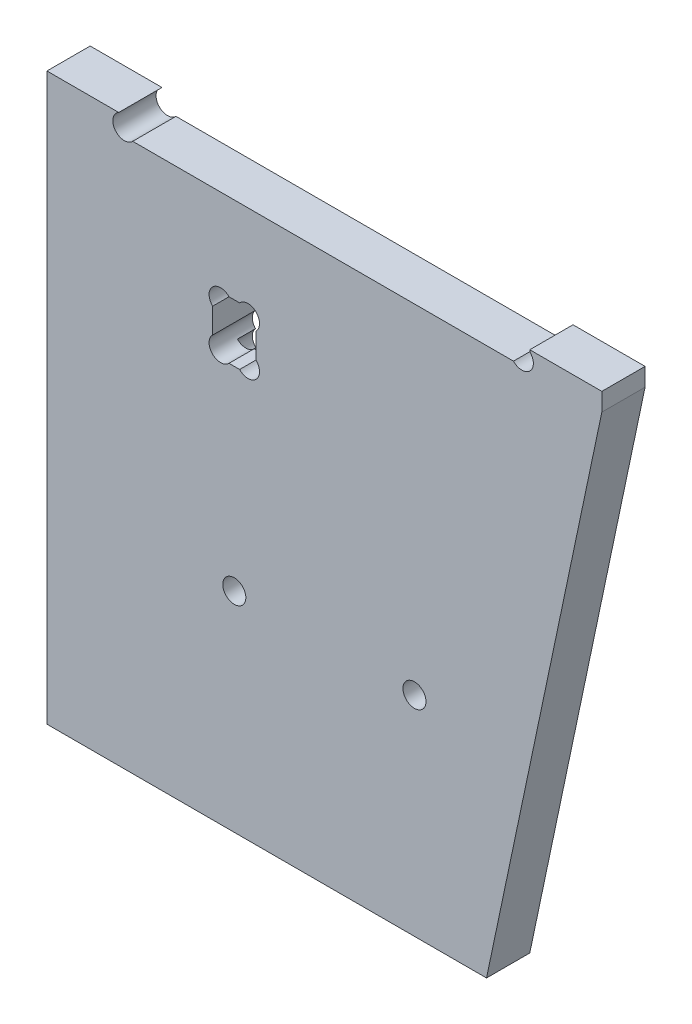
SolidWorks part; units mm, degrees
ref_plane "Plan de face" through (0, 0, 0) normal (0, 0, 1) x (1, 0, 0)
ref_plane "Plan de dessus" through (0, 0, 0) normal (0, 1, 0) x (1, 0, 0)
ref_plane "Plan de droite" through (0, 0, 0) normal (1, 0, 0) x (0, 0, -1)
sketch "Esquisse1" plane through (0, 0, 0) normal (0, 0, 1) x (1, 0, 0)
  line L0 (0, 65.0081) -> (0, -9.9384) construction
  line L1 (11.7393, 0) -> (-31.8718, 0) construction
  line L2 (9.1967, 12) -> (-23.9296, 12) construction
  line L3 (9.1967, 42) -> (-19.8178, 42) construction
  line L4 (9.1967, 54) -> (-19.8178, 54) construction
  line L5 (-6, 65.0081) -> (-6, -9.9384) construction
  line L6 (2.8612, 42) -> (2.8612, 12) construction
  line L7 (1.6817, 48) -> (-10.3124, 48) construction
  line L8 (-2.2619, 54) -> (-3.7381, 54) construction
  line L9 (0, 51.7381) -> (0, 44.2619)
  line L10 (-2.2619, 42) -> (-3.7381, 42)
  line L11 (-6, 51.7381) -> (-6, 44.2619)
  line L12 (-3, 54.8011) -> (-3, 40.0837) construction
  line L13 (2.8612, 27) -> (-11.4211, 27) construction
  line L14 (25.4842, 10) -> (-16.2282, 10) construction
  line L15 (-6, -2) -> (-6, 7.7381)
  line L16 (-3.7381, 10) -> (-2.2619, 10)
  line L17 (38.4169, -2) -> (-46.0794, -2) construction
  line L18 (17, 79.5439) -> (17, -29.3046) construction
  line L19 (-31, 83.2548) -> (-31, -44.3973) construction
  line L20 (57.319, 74) -> (-78.5779, 74) construction
  line L21 (23, 62.8857) -> (23, -51.6502) construction
  line L22 (30, 62.8857) -> (30, -54.9729) construction
  line L23 (-31, 0) -> (-31, 74)
  line L24 (30, -2) -> (46, 74)
  line L25 (33.7381, 74) -> (-19.0967, 74)
  line L26 (0, 7.7381) -> (0, -2)
  line L27 (0, -2) -> (17, -2)
  line L28 (17, -2) -> (17, 7.7381)
  line L29 (3.4839, 62) -> (-9.6947, 62) construction
  line L30 (0, 51.7381) -> (0, 59.7381)
  line L31 (-2.2619, 62) -> (-3.7381, 62)
  line L32 (-6, 59.7381) -> (-6, 51.7381)
  line L33 (17, 6.0366) -> (0, 6) construction
  line L34 (8.5, 9.2575) -> (8.5, 3.2101) construction
  line L35 (19.2619, 10) -> (20.7381, 10)
  line L36 (23, 7.7381) -> (23, -2)
  line L37 (23, -2) -> (30, -2)
  line L38 (-6, -2) -> (-31, -2)
  line L39 (17, 51.7381) -> (17, 44.2619)
  line L40 (23, 51.7381) -> (23, 44.2619)
  line L41 (19.2619, 42) -> (20.7381, 42)
  line L42 (20, 42) -> (20, 46.358) construction
  line L43 (20.7381, 54) -> (19.2619, 54)
  line L44 (20, 42) -> (20, 12) construction
  line L45 (-31, -2) -> (-31, 0)
  line L46 (-3, 10) -> (-3, 2.1006) construction
  line L47 (-42.5287, 80) -> (78.4783, 80) construction
  line L48 (-21, 86.0943) -> (-21, 72.2146) construction
  line L49 (7.3207, 75.5379) -> (7.3207, 90.5905) construction
  line L50 (36, 88.6356) -> (36, 76.2619) construction
  line L51 (-31, 74) -> (-31, 80)
  line L52 (-31, 80) -> (-21, 80)
  line L53 (-21, 80) -> (-21, 76.5178)
  line L54 (46, 74) -> (46, 80)
  line L55 (46, 80) -> (36, 80)
  line L56 (36, 80) -> (36, 76.2619)
  line L57 (36, 74) -> (36, 72.2146) construction
  arc A0 (0, 51.7381) -> (-2.2619, 54) centre (-1.1, 52.9) ccw construction
  arc A1 (0, 59.7381) -> (-2.2619, 62) centre (-1.1, 60.9) ccw
  arc A2 (-6, 44.2619) -> (-3.7381, 42) centre (-4.9, 43.1) ccw
  arc A3 (0, 44.2619) -> (-2.2619, 42) centre (-1.1, 43.1) cw
  arc A4 (-3.7381, 10) -> (-6, 7.7381) centre (-4.9, 8.9) ccw
  arc A5 (-2.2619, 10) -> (0, 7.7381) centre (-1.1, 8.9) cw
  arc A6 (-6, 59.7381) -> (-3.7381, 62) centre (-4.9, 60.9) cw
  arc A7 (20.7381, 10) -> (23, 7.7381) centre (21.9, 8.9) cw
  arc A8 (19.2619, 10) -> (17, 7.7381) centre (18.1, 8.9) ccw
  arc A9 (17, 51.7381) -> (19.2619, 54) centre (18.1, 52.9) cw construction
  arc A10 (23, 44.2619) -> (20.7381, 42) centre (21.9, 43.1) cw
  arc A11 (17, 44.2619) -> (19.2619, 42) centre (18.1, 43.1) ccw
  arc A12 (19.2619, 54) -> (17, 51.7381) centre (18.1, 52.9) ccw
  arc A13 (20.7381, 54) -> (23, 51.7381) centre (21.9, 52.9) cw
  circle A14 centre (20, 27) radius 1.6
  circle A15 centre (-3, 27) radius 1.6
  arc A16 (33.7381, 74) -> (36, 76.2619) centre (34.9, 75.1) ccw
  arc A17 (-19.0967, 74) -> (-21, 76.5178) centre (-20.2586, 75.1) cw
  dimension "D3" = 2
  dimension "D10" = 20
  dimension "D12" = 8
  dimension "D7" = 1.1
  dimension "D13" = 1.1
  dimension "D16" = 1.1
  dimension "D22" = 1.1
  dimension "D1" = 54
  dimension "D2" = 12
  dimension "D4" = 6
  dimension "D5" = 17
  dimension "D6" = 6
  dimension "D8" = 1.1
  dimension "D9" = 7
  dimension "D11" = 25
  dimension "D14" = 1.1
  dimension "D15" = 2
  dimension "D17" = 1.1
  dimension "D18" = 77
  dimension "D19" = 6
  dimension "D20" = 10
  dimension "D21" = 10
  dimension "D23" = 1.1
sketch "Esquisse2" plane through (0, 0, 0) normal (0, 0, 1) x (1, 0, 0)
  line L3 (-31, 80) -> (-21, 80) construction
  line L19 (-21, 80) -> (-21, 76.5178) construction
  line L20 (33.7381, 74) -> (-19.0967, 74) construction
  line L21 (36, 80) -> (36, 76.2619) construction
  line L22 (46, 80) -> (36, 80) construction
  line L23 (46, 74) -> (46, 80) construction
  line L24 (30, -2) -> (46, 74) construction
  line L25 (-31, 0) -> (-31, 74) construction
  line L26 (-31, 74) -> (-31, 80) construction
  line L27 (-31, -2) -> (-31, 0) construction
  line L28 (-6, -2) -> (-31, -2) construction
  line L29 (23, -2) -> (30, -2) construction
  line L30 (-31, 80) -> (-21, 80)
  line L31 (-21, 80) -> (-21, 76.5178)
  line L32 (33.7381, 74) -> (-19.0967, 74)
  line L33 (36, 80) -> (36, 76.2619)
  line L34 (46, 80) -> (36, 80)
  line L35 (46, 74) -> (46, 80)
  line L36 (30, -2) -> (46, 74)
  line L37 (-31, 0) -> (-31, 74)
  line L38 (-31, 74) -> (-31, 80)
  line L39 (-31, -2) -> (-31, 0)
  line L40 (-6, -2) -> (-31, -2)
  line L41 (23, -2) -> (30, -2)
  line L42 (23, -2) -> (-6, -2)
  arc A3 (-21, 76.5178) -> (-19.0967, 74) centre (-20.2586, 75.1) ccw construction
  arc A5 (33.7381, 74) -> (36, 76.2619) centre (34.9, 75.1) ccw construction
  arc A10 (-21, 76.5178) -> (-19.0967, 74) centre (-20.2586, 75.1) ccw
  arc A11 (33.7381, 74) -> (36, 76.2619) centre (34.9, 75.1) ccw
extrude "Boss.-Extru.1" add sketch "Esquisse2" against normal blind 6
sketch "Esquisse5" plane through (0, 0, 0) normal (0, 0, 1) x (1, 0, 0)
  circle A1 centre (20, 27) radius 1.6 construction
  circle A2 centre (-5, 27) radius 1.6
  circle A3 centre (20, 27) radius 1.6
extrude "Enlèv. mat.-Extru.3" cut sketch "Esquisse5" against normal through all
sketch "Esquisse6" plane through (0, 0, -6) normal (0, 0, 1) x (1, 0, 0)
  line L4 (20.7381, 54) -> (19.2619, 54) construction
  line L5 (23, 51.7381) -> (23, 44.2619) construction
  line L6 (17, 51.7381) -> (17, 44.2619) construction
  line L7 (19.2619, 42) -> (20.7381, 42) construction
  line L8 (-5.7381, 54) -> (-4.2619, 54)
  line L9 (-2, 51.7381) -> (-2, 44.2619)
  line L10 (-8, 51.7381) -> (-8, 44.2619)
  line L11 (-4.2619, 42) -> (-5.7381, 42)
  line L12 (20.7381, 54) -> (19.2619, 54)
  line L13 (23, 51.7381) -> (23, 44.2619)
  line L14 (17, 51.7381) -> (17, 44.2619)
  line L15 (19.2619, 42) -> (20.7381, 42)
  line L18 (-5, 47.4424) -> (-5, 57.5634) construction
  line L19 (19.2619, 10) -> (20.7381, 10) construction
  line L20 (23, 7.7381) -> (23, -2) construction
  line L21 (17, -2) -> (17, 7.7381) construction
  line L25 (19.2619, 10) -> (20.7381, 10)
  line L26 (23, 7.7381) -> (23, -2)
  line L27 (17, -2) -> (17, 7.7381)
  line L28 (-2, 7.7381) -> (-2, -2)
  line L29 (-8, -2) -> (-8, 7.7381)
  line L30 (-5.7381, 10) -> (-4.2619, 10)
  line L31 (-8, -2) -> (-8, -4.5)
  line L33 (-8, -4.5) -> (-2, -4.5)
  line L35 (-2, -4.5) -> (-2, -2)
  line L36 (-6, -2) -> (-31, -2) construction
  line L37 (17, -2) -> (17, -4.5)
  line L38 (17, 79.5439) -> (17, -29.3046) construction
  line L39 (17, -4.5) -> (23, -4.5)
  line L40 (23, 62.8857) -> (23, -51.6502) construction
  line L41 (23, -4.5) -> (23, -2)
  arc A2 (19.2619, 54) -> (17, 51.7381) centre (18.1, 52.9) ccw construction
  arc A3 (23, 51.7381) -> (20.7381, 54) centre (21.9, 52.9) ccw construction
  arc A4 (17, 44.2619) -> (19.2619, 42) centre (18.1, 43.1) ccw construction
  arc A5 (20.7381, 42) -> (23, 44.2619) centre (21.9, 43.1) ccw construction
  arc A6 (-8, 44.2619) -> (-5.7381, 42) centre (-6.9, 43.1) ccw
  arc A7 (-4.2619, 42) -> (-2, 44.2619) centre (-3.1, 43.1) ccw
  arc A8 (19.2619, 54) -> (17, 51.7381) centre (18.1, 52.9) ccw
  arc A9 (23, 51.7381) -> (20.7381, 54) centre (21.9, 52.9) ccw
  arc A10 (17, 44.2619) -> (19.2619, 42) centre (18.1, 43.1) ccw
  arc A11 (20.7381, 42) -> (23, 44.2619) centre (21.9, 43.1) ccw
  arc A13 (19.2619, 10) -> (17, 7.7381) centre (18.1, 8.9) ccw construction
  arc A14 (23, 7.7381) -> (20.7381, 10) centre (21.9, 8.9) ccw construction
  arc A17 (19.2619, 10) -> (17, 7.7381) centre (18.1, 8.9) ccw
  arc A18 (23, 7.7381) -> (20.7381, 10) centre (21.9, 8.9) ccw
  arc A19 (-2, 7.7381) -> (-4.2619, 10) centre (-3.1, 8.9) ccw
  arc A20 (-5.7381, 10) -> (-8, 7.7381) centre (-6.9, 8.9) ccw
  arc A21 (-2, 51.7381) -> (-4.2619, 54) centre (-3.1, 52.9) ccw
  arc A22 (-8, 51.7381) -> (-5.7381, 54) centre (-6.9, 52.9) cw
  dimension "D1" = 2.5
extrude "Enlèv. mat.-Extru.4" cut sketch "Esquisse6" along normal blind 2.5
sketch "Esquisse7" plane through (0, 0, 0) normal (0, 0, 1) x (1, 0, 0)
  line L0 (-5, 54) -> (-5, 62) construction
  line L5 (-8.424, 58) -> (-0.9868, 58) construction
  line L6 (-5.7381, 62) -> (-4.2619, 62)
  line L7 (-2, 59.7381) -> (-2, 56.2619)
  line L9 (-5.7381, 54) -> (-4.2619, 54)
  line L10 (-8, 59.7381) -> (-8, 56.2619)
  arc A0 (-2, 59.7381) -> (-4.2619, 62) centre (-3.1, 60.9) ccw
  arc A1 (-5.7381, 62) -> (-8, 59.7381) centre (-6.9, 60.9) ccw
  arc A2 (-5.7381, 54) -> (-8, 56.2619) centre (-6.9, 55.1) cw
  arc A3 (-4.2619, 54) -> (-2, 56.2619) centre (-3.1, 55.1) ccw
extrude "Enlèv. mat.-Extru.5" cut sketch "Esquisse7" against normal blind 10
sketch "Esquisse8" plane through (0, 0, -6) normal (0, 0, -1) x (-1, 0, 0)
  line L0 (-33.7381, 74) -> (19.0967, 74) construction
  line L1 (-64.571, 93.1625) -> (42.2402, 93.1625)
  line L2 (-64.571, 93.1625) -> (-64.571, 76.5)
  line L3 (-64.571, 76.5) -> (42.2402, 76.5)
  line L4 (42.2402, 93.1625) -> (42.2402, 76.5)
  dimension "D1" = 2.5
extrude "Enlèv. mat.-Extru.6" cut sketch "Esquisse8" against normal blind 10
